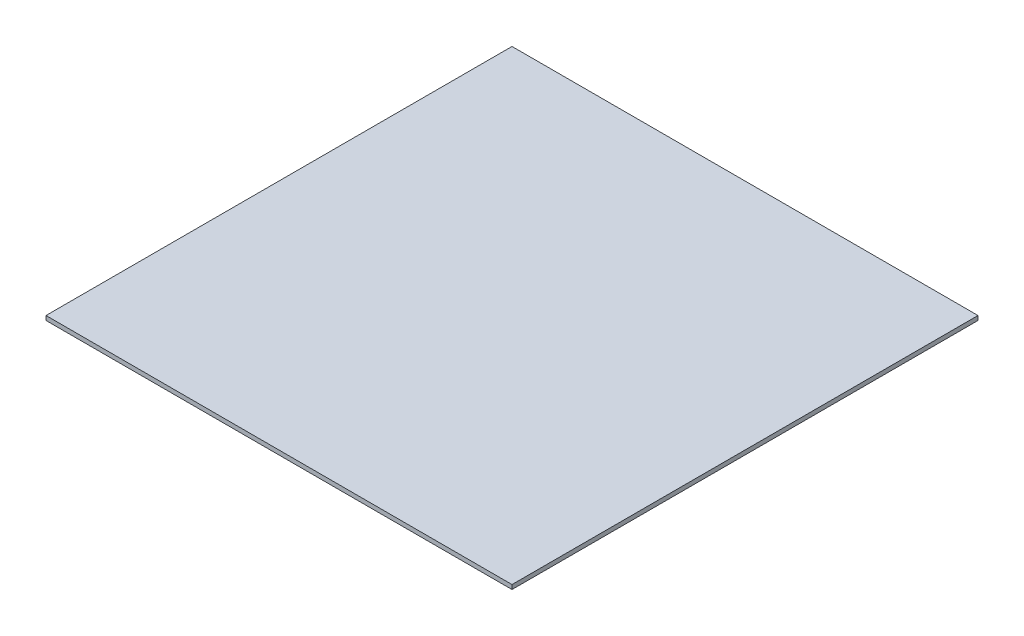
SolidWorks part; units mm, degrees
ref_plane "Front Plane" through (0, 0, 0) normal (0, 0, 1) x (1, 0, 0)
ref_plane "Top Plane" through (0, 0, 0) normal (0, 1, 0) x (1, 0, 0)
ref_plane "Right Plane" through (0, 0, 0) normal (1, 0, 0) x (0, 0, -1)
sketch "Sketch1" plane through (0, 0, 0) normal (0, 1, 0) x (1, 0, 0)
  line L1 (-215, 215) -> (215, 215)
  line L2 (-215, 215) -> (-215, -215)
  line L3 (-215, -215) -> (215, -215)
  line L4 (215, 215) -> (215, -215)
  line L5 (-215, 215) -> (215, -215) construction
  line L6 (-215, -215) -> (215, 215) construction
  point P0 (0, 0)
extrude "Boss-Extrude1" add sketch "Sketch1" along normal blind 4
